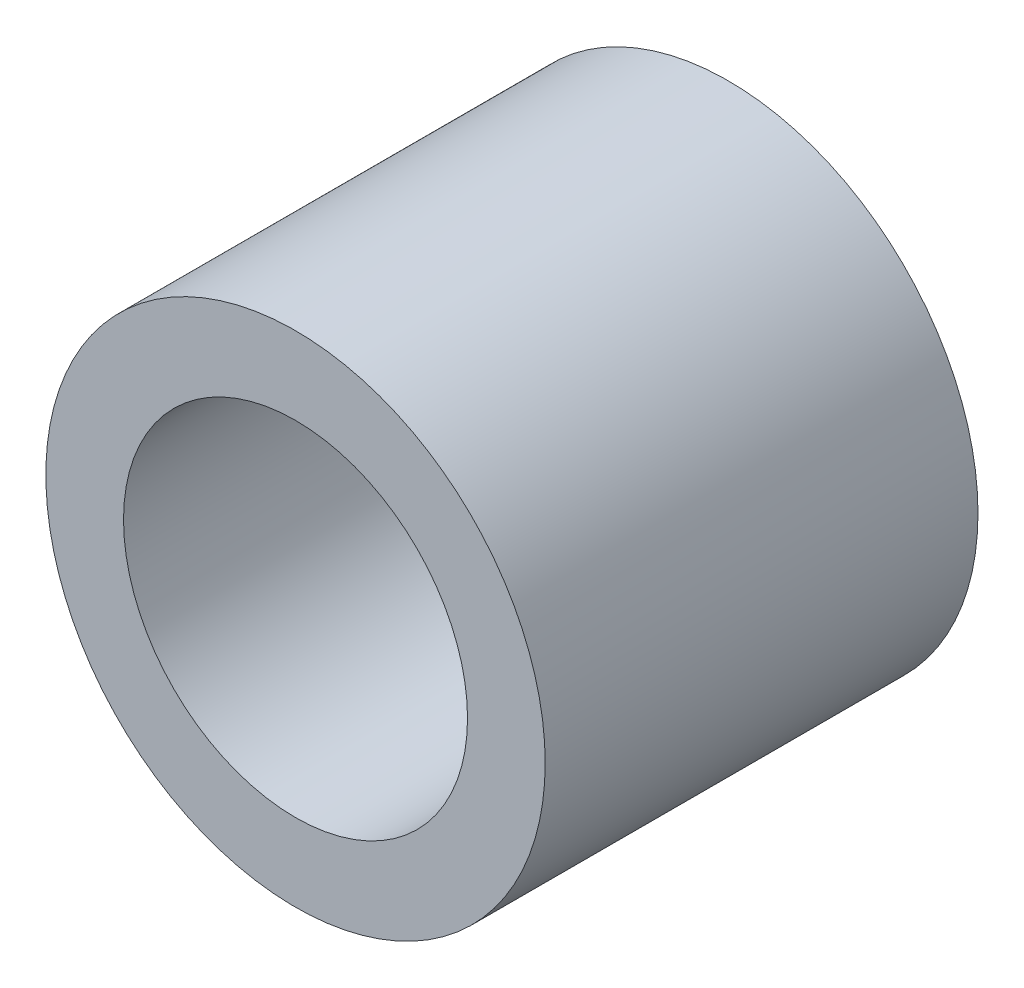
SolidWorks part; units mm, degrees
ref_plane "Alzado" through (0, 0, 0) normal (0, 0, 1) x (1, 0, 0)
ref_plane "Planta" through (0, 0, 0) normal (0, 1, 0) x (1, 0, 0)
ref_plane "Vista lateral" through (0, 0, 0) normal (1, 0, 0) x (0, 0, -1)
ref_plane "Plano1" through (0, 0, 6.2) normal (0, 0, 1) x (1, 0, 0)
sketch "Sk_Casquillo" plane through (0, 0, 6.2) normal (0, 0, 1) x (1, 0, 0)
  circle A0 centre (-36, -62) radius 4.5
  circle A1 centre (-36, -62) radius 3.1
extrude "Casquillo" add sketch "Sk_Casquillo" along normal blind 7.8
